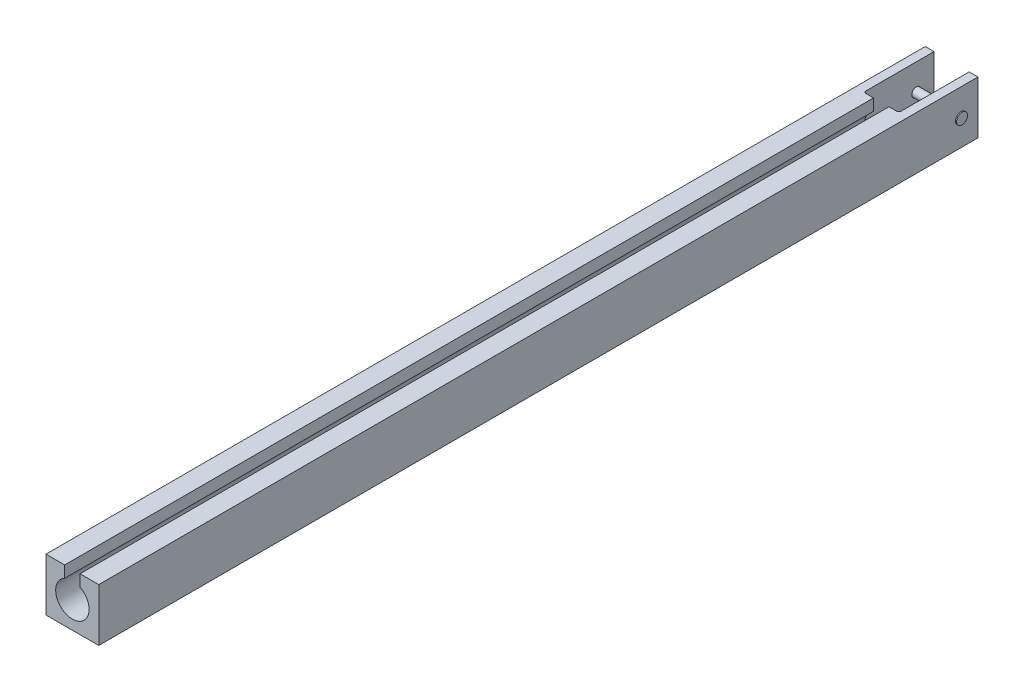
SolidWorks part; units mm, degrees
ref_plane "Front Plane" through (0, 0, 0) normal (0, 0, 1) x (1, 0, 0)
ref_plane "Top Plane" through (0, 0, 0) normal (0, 1, 0) x (1, 0, 0)
ref_plane "Right Plane" through (0, 0, 0) normal (1, 0, 0) x (0, 0, -1)
sketch "Sketch1" plane through (0, 0, 0) normal (1, 0, 0) x (0, 0, -1)
  line L0 (0, 0) -> (-862.1046, 862.1046) construction
  line L1 (-359.2102, 359.2102) -> (-718.4205, 0) construction
  line L2 (-718.4205, 0) -> (0, 0) construction
  dimension "D1" = 1219.2
  dimension "D2" = 508
  dimension "D3" = 508
  dimension "D4" = 45
sketch "Sketch2" plane through (0, 0, 0) normal (1, 0, 0) x (0, 0, -1)
  line L0 (-718.4205, 0) -> (0, 0) construction
  line L1 (-1244.6, -38.1) -> (25.4, -38.1)
  line L2 (-1244.6, -38.1) -> (-1244.6, 38.1)
  line L3 (-1244.6, 38.1) -> (25.4, 38.1)
  line L4 (25.4, -38.1) -> (25.4, 38.1)
  line L5 (-1244.6, -38.1) -> (25.4, 38.1) construction
  line L6 (-1244.6, 38.1) -> (25.4, -38.1) construction
  point P0 (-609.6, 0)
  dimension "D1" = 76.2
  dimension "D2" = 1270
  dimension "D3" = 25.4
extrude "Boss-Extrude1" add sketch "Sketch2" along normal mid plane 76.2
sketch "Sketch3" plane through (0, 0, -25.4) normal (0, 0, -1) x (-1, 0, 0)
  line L0 (-38.1, 38.1) -> (38.1, 38.1) construction
  line L1 (-25.4, 38.1) -> (25.4, 38.1)
  line L2 (-25.4, 38.1) -> (-25.4, -28.575)
  line L3 (-25.4, -28.575) -> (25.4, -28.575)
  line L4 (25.4, 38.1) -> (25.4, -28.575)
  point P4 (0, 38.1)
  dimension "D1" = 50.8
  dimension "D2" = 66.675
extrude "Cut-Extrude1" cut sketch "Sketch3" against normal blind 101.6
sketch "Sketch4" plane through (0, 0, 76.2) normal (0, 0, -1) x (-1, 0, 0)
  line L0 (-11.1125, 21.4189) -> (-11.1125, 38.1)
  line L1 (-11.1125, 38.1) -> (11.1125, 38.1)
  line L2 (11.1125, 38.1) -> (11.1125, 21.4189)
  line L3 (0, 0) -> (0, 38.1) construction
  line L4 (25.4, 38.1) -> (-25.4, 38.1) construction
  circle A0 centre (0, 0) radius 24.13 construction
  arc A1 (11.1125, 21.4189) -> (-11.1125, 21.4189) centre (0, 0) cw
  dimension "D1" = 48.26
  dimension "D2" = 22.225
extrude "Cut-Extrude2" cut sketch "Sketch4" against normal through all
sketch "Sketch5" plane through (38.1, 0, 0) normal (1, 0, 0) x (0, 0, -1)
  circle A0 centre (0, 0) radius 6.731
  dimension "D1" = 13.462
extrude "Cut-Extrude3" cut sketch "Sketch5" against normal through all
fillet "Fillet1" radius 3.175 5 edges at (-25.4, -28.575, 25.4) (25.4, -28.575, 25.4) (0, -28.575, 76.2) (25.4, 4.7625, 76.2) (-25.4, 4.7625, 76.2)
sketch "Sketch6" plane through (0, 0, 0) normal (1, 0, 0) x (0, 0, -1)
  circle A0 centre (0, 0) radius 6.35
  dimension "D1" = 12.7
extrude "Boss-Extrude2" add sketch "Sketch6" along normal mid plane 77.7875 separate body
sketch "Sketch7" plane through (38.8937, 0, 0) normal (1, 0, 0) x (0, 0, -1)
  circle A0 centre (0, 0) radius 7.9375
  dimension "D1" = 15.875
extrude "Boss-Extrude3" add sketch "Sketch7" along normal blind 1.5875
mirror "Mirror1" about plane through (0, 0, 0) normal (1, 0, 0) of "Boss-Extrude3"
